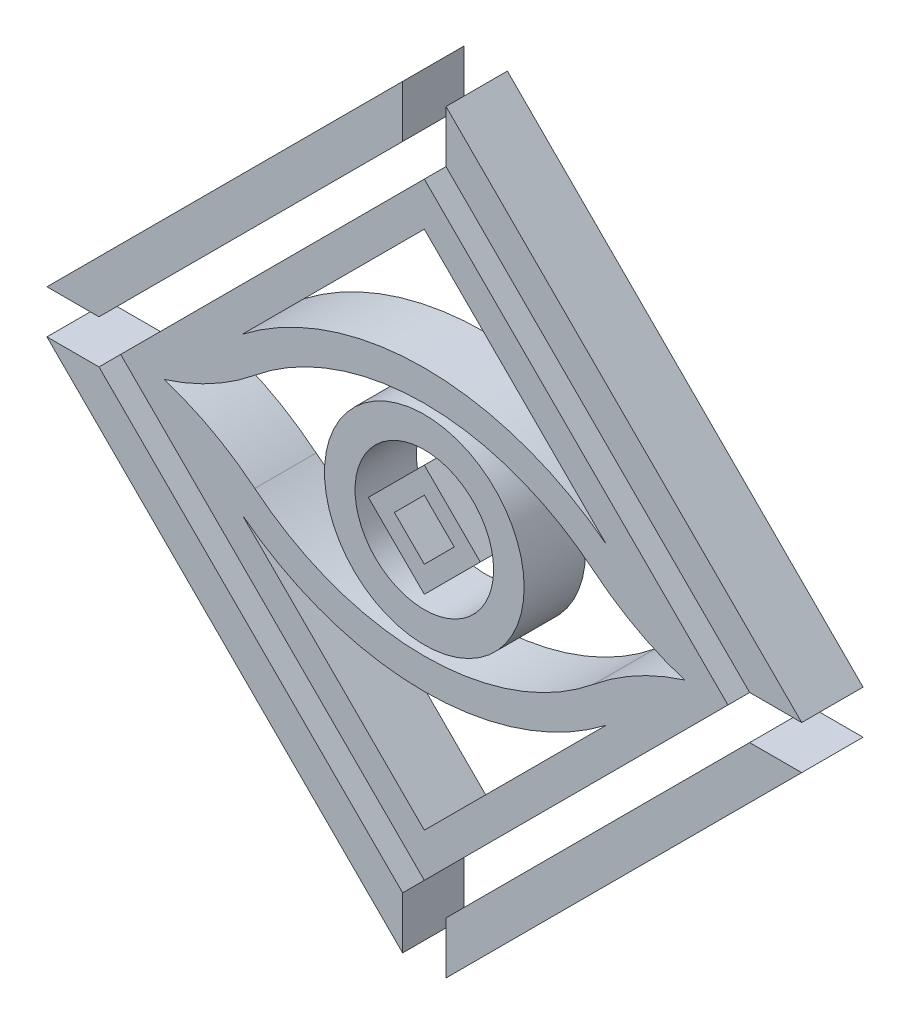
SolidWorks part; units mm, degrees
ref_plane "Alzado" through (0, 0, 0) normal (0, 0, 1) x (1, 0, 0)
ref_plane "Planta" through (0, 0, 0) normal (0, 1, 0) x (1, 0, 0)
ref_plane "Vista lateral" through (0, 0, 0) normal (1, 0, 0) x (0, 0, -1)
sketch "Croquis1" plane through (0, 0, 0) normal (0, 0, 1) x (1, 0, 0)
  line L0 (0, 0) -> (0, 50000) construction
  line L1 (37.6583, 4.7681) -> (0, 42.4264)
  line L2 (0, 42.4264) -> (-37.6583, 4.7681)
  line L3 (-37.6583, -4.7681) -> (0, -42.4264)
  line L4 (0, -42.4264) -> (37.6583, -4.7681)
  line L5 (-1100.6117, 0) -> (-48.9639, 0) construction
  line L6 (0, 49.4975) -> (-49.4975, 0)
  line L7 (-49.4975, 0) -> (0, -49.4975)
  line L8 (0, -49.4975) -> (49.4975, 0)
  line L9 (49.4975, 0) -> (0, 49.4975)
  line L10 (-48.9639, 0) -> (-42.4264, 0) construction
  line L11 (-42.4264, 0) -> (42.4264, 0) construction
  line L12 (42.4264, 0) -> (48.9639, 0) construction
  line L13 (48.9639, 0) -> (50002.6839, 0) construction
  line L14 (42.4264, 0) -> (37.6583, 4.7681) construction
  line L15 (42.4264, 0) -> (0, 42.4264) construction
  line L16 (37.6583, -4.7681) -> (42.4264, 0) construction
  line L17 (0, -42.4264) -> (42.4264, 0) construction
  line L18 (-37.6583, 4.7681) -> (-42.4264, 0) construction
  line L19 (0, 42.4264) -> (-42.4264, 0) construction
  line L20 (-42.4264, 0) -> (-37.6583, -4.7681) construction
  line L21 (-42.4264, 0) -> (0, -42.4264) construction
  line L23 (9.1219, 0) -> (0, 9.1219)
  line L24 (0, 9.1219) -> (-9.1219, 0)
  line L25 (-9.1219, 0) -> (0, -9.1219)
  line L26 (0, -9.1219) -> (9.1219, 0)
  line L27 (5.6426, 0) -> (0, 5.6426)
  line L28 (0, 5.6426) -> (-5.6426, 0)
  line L29 (-5.6426, 0) -> (0, -5.6426)
  line L30 (0, -5.6426) -> (5.6426, 0)
  circle A0 centre (0, 0) radius 30 construction
  arc A1 (-42.4264, 0) -> (-31.8477, 6.7199) centre (-56.7328, 34.2081) ccw
  arc A2 (-42.4264, 0) -> (-31.8477, -6.7199) centre (-56.7328, -34.2081) cw
  arc A3 (42.4264, 0) -> (31.8477, 6.7199) centre (56.7328, 34.2081) cw
  arc A4 (42.4264, 0) -> (31.8477, -6.7199) centre (56.7328, -34.2081) ccw
  arc A5 (-31.8477, 6.7199) -> (31.8477, 6.7199) centre (0, -28.4594) cw
  arc A6 (-31.8477, -6.7199) -> (31.8477, -6.7199) centre (0, 28.4594) ccw
  circle A7 centre (0, 0) radius 13.1025
  arc A8 (-33.19, 8.2026) -> (33.19, 8.2026) centre (0, -28.4594) cw
  arc A9 (37.6583, 4.7681) -> (33.19, 8.2026) centre (56.7328, 34.2081) cw
  arc A10 (37.6583, -4.7681) -> (33.19, -8.2026) centre (56.7328, -34.2081) ccw
  arc A11 (-33.19, -8.2026) -> (33.19, -8.2026) centre (0, 28.4594) ccw
  arc A12 (-37.6583, -4.7681) -> (-33.19, -8.2026) centre (-56.7328, -34.2081) cw
  arc A13 (-37.6583, 4.7681) -> (-33.19, 8.2026) centre (-56.7328, 34.2081) ccw
  arc A14 (-48.9639, 0) -> (-37.6583, -4.7681) centre (-56.7328, -34.2081) cw construction
  arc A15 (-48.9639, 0) -> (-33.19, -8.2026) centre (-56.7328, -34.2081) cw construction
  arc A16 (-48.9639, 0) -> (-37.6583, 4.7681) centre (-56.7328, 34.2081) ccw construction
  arc A17 (-48.9639, 0) -> (-33.19, 8.2026) centre (-56.7328, 34.2081) ccw construction
  arc A18 (48.9639, 0) -> (37.6583, -4.7681) centre (56.7328, -34.2081) ccw construction
  arc A19 (48.9639, 0) -> (33.19, -8.2026) centre (56.7328, -34.2081) ccw construction
  arc A20 (48.9639, 0) -> (37.6583, 4.7681) centre (56.7328, 34.2081) cw construction
  arc A21 (48.9639, 0) -> (33.19, 8.2026) centre (56.7328, 34.2081) cw construction
  circle A22 centre (0, 0) radius 11.2928
  circle A23 centre (0, 0) radius 6.4502 construction
  circle A24 centre (0, 0) radius 3.9899 construction
  point P22 (0, 0)
  dimension "D2" = 5
  dimension "D1" = 60
  dimension "D3" = 2
extrude "Saliente-Extruir1" add sketch "Croquis1" along normal mid plane 10 contours L8 L9 L6 L7 A13 L2 L1 A9 A8 A6 A2 A1 A5 A3 A4 L3 A12 A11 A10 L4 | A7 A22 | L25 L26 L23 L24 L30 L29 L28 L27
sketch "Croquis3" plane through (0, 0, 5) normal (0, 0, 1) x (1, 0, 0)
  line L0 (-40.2211, 6.1456) -> (-39.0374, 3.389)
  line L1 (40.2211, 6.1456) -> (39.0374, 3.389)
  line L2 (39.0374, -3.389) -> (40.2211, -6.1456)
  line L3 (-39.0374, -3.389) -> (-40.2211, -6.1456)
  arc A30 (30.8036, 11.8604) -> (40.2211, 6.1456) centre (55.8123, 42.4554) ccw
  arc A31 (30.8036, 11.8604) -> (-30.8036, 11.8604) centre (0, -25.8239) ccw
  arc A32 (-40.2211, 6.1456) -> (-30.8036, 11.8604) centre (-55.8123, 42.4554) ccw
  arc A33 (30.8036, 11.8604) -> (40.2211, 6.1456) centre (55.8123, 42.4554) ccw
  arc A34 (30.8036, 11.8604) -> (-30.8036, 11.8604) centre (0, -25.8239) ccw
  arc A35 (-40.2211, 6.1456) -> (-30.8036, 11.8604) centre (-55.8123, 42.4554) ccw
  arc A39 (-39.0374, 3.389) -> (-28.905, 9.5377) centre (-55.8123, 42.4554) ccw construction
  arc A40 (28.905, 9.5377) -> (-28.905, 9.5377) centre (0, -25.8239) ccw construction
  arc A41 (28.905, 9.5377) -> (39.0374, 3.389) centre (55.8123, 42.4554) ccw construction
  arc A42 (40.2211, -6.1456) -> (30.8036, -11.8604) centre (55.8123, -42.4554) ccw
  arc A43 (-30.8036, -11.8604) -> (30.8036, -11.8604) centre (0, 25.8239) ccw
  arc A44 (-30.8036, -11.8604) -> (-40.2211, -6.1456) centre (-55.8123, -42.4554) ccw
  arc A45 (40.2211, -6.1456) -> (30.8036, -11.8604) centre (55.8123, -42.4554) ccw
  arc A46 (-30.8036, -11.8604) -> (30.8036, -11.8604) centre (0, 25.8239) ccw
  arc A47 (-30.8036, -11.8604) -> (-40.2211, -6.1456) centre (-55.8123, -42.4554) ccw
  arc A48 (39.0374, -3.389) -> (28.905, -9.5377) centre (55.8123, -42.4554) ccw construction
  arc A49 (-28.905, -9.5377) -> (28.905, -9.5377) centre (0, 25.8239) ccw construction
  arc A50 (-28.905, -9.5377) -> (-39.0374, -3.389) centre (-55.8123, -42.4554) ccw construction
  arc A51 (-39.0374, 3.389) -> (-28.905, 9.5377) centre (-55.8123, 42.4554) ccw
  arc A52 (28.905, 9.5377) -> (-28.905, 9.5377) centre (0, -25.8239) ccw
  arc A53 (28.905, 9.5377) -> (39.0374, 3.389) centre (55.8123, 42.4554) ccw
  arc A54 (39.0374, -3.389) -> (28.905, -9.5377) centre (55.8123, -42.4554) ccw
  arc A55 (-28.905, -9.5377) -> (28.905, -9.5377) centre (0, 25.8239) ccw
  arc A56 (-28.905, -9.5377) -> (-39.0374, -3.389) centre (-55.8123, -42.4554) ccw
  dimension "D1" = 3
  dimension "D2" = 3
extrude "Saliente-Extruir2" add sketch "Croquis3" against normal blind 10
sketch "Croquis4" plane through (0, 0, 5) normal (0, 0, 1) x (1, 0, 0)
  line L0 (-9.1219, 0) -> (0, 9.1219)
  line L1 (0, 9.1219) -> (9.1219, 0)
  line L2 (9.1219, 0) -> (0, -9.1219)
  line L3 (0, -9.1219) -> (-9.1219, 0)
  line L4 (-4.8793, 0) -> (0, 4.8793)
  line L5 (0, 4.8793) -> (4.8793, 0)
  line L6 (4.8793, 0) -> (0, -4.8793)
  line L7 (0, -4.8793) -> (-4.8793, 0)
  circle A0 centre (0, 0) radius 11.2732
  circle A1 centre (0, 0) radius 16.2732
  dimension "D1" = 5
  dimension "D2" = 3
extrude "Saliente-Extruir3" add sketch "Croquis4" against normal blind 10 contours A1 M8 | L3 L2 L1 L0 L6 L7 L4 L5
sketch "Croquis5" plane through (0, 0, 5) normal (0, 0, 1) x (1, 0, 0)
  line L6 (-3.5355, -53.033) -> (-3.5355, -61.5183)
  line L7 (-3.5355, -61.5183) -> (-61.5183, -3.5355)
  line L8 (-61.5183, -3.5355) -> (-53.033, -3.5355)
  line L9 (0, 0) -> (0, -50000) construction
  line L10 (0, 0) -> (50000, 0) construction
  line L11 (-53.033, -3.5355) -> (-3.5355, -53.033)
  line L12 (-53.033, -3.5355) -> (-3.5355, -53.033)
  line L13 (61.5183, -3.5355) -> (53.033, -3.5355)
  line L14 (3.5355, -53.033) -> (53.033, -3.5355)
  line L15 (3.5355, -53.033) -> (53.033, -3.5355)
  line L16 (3.5355, -61.5183) -> (61.5183, -3.5355)
  line L17 (-3.5355, 53.033) -> (-53.033, 3.5355)
  line L18 (-3.5355, 53.033) -> (-53.033, 3.5355)
  line L19 (3.5355, -53.033) -> (3.5355, -61.5183)
  line L20 (53.033, 3.5355) -> (3.5355, 53.033)
  line L21 (53.033, 3.5355) -> (3.5355, 53.033)
  line L22 (3.5355, 53.033) -> (3.5355, 61.5183)
  line L23 (3.5355, 61.5183) -> (61.5183, 3.5355)
  line L24 (61.5183, 3.5355) -> (53.033, 3.5355)
  line L25 (-61.5183, 3.5355) -> (-53.033, 3.5355)
  line L26 (-3.5355, 61.5183) -> (-61.5183, 3.5355)
  line L27 (-3.5355, 53.033) -> (-3.5355, 61.5183)
  dimension "D5" = 6
  dimension "D1" = 5
  dimension "D2" = 5
  dimension "D3" = 5
  dimension "D4" = 5
extrude "Saliente-Extruir4" add sketch "Croquis5" against normal blind 10 separate body
